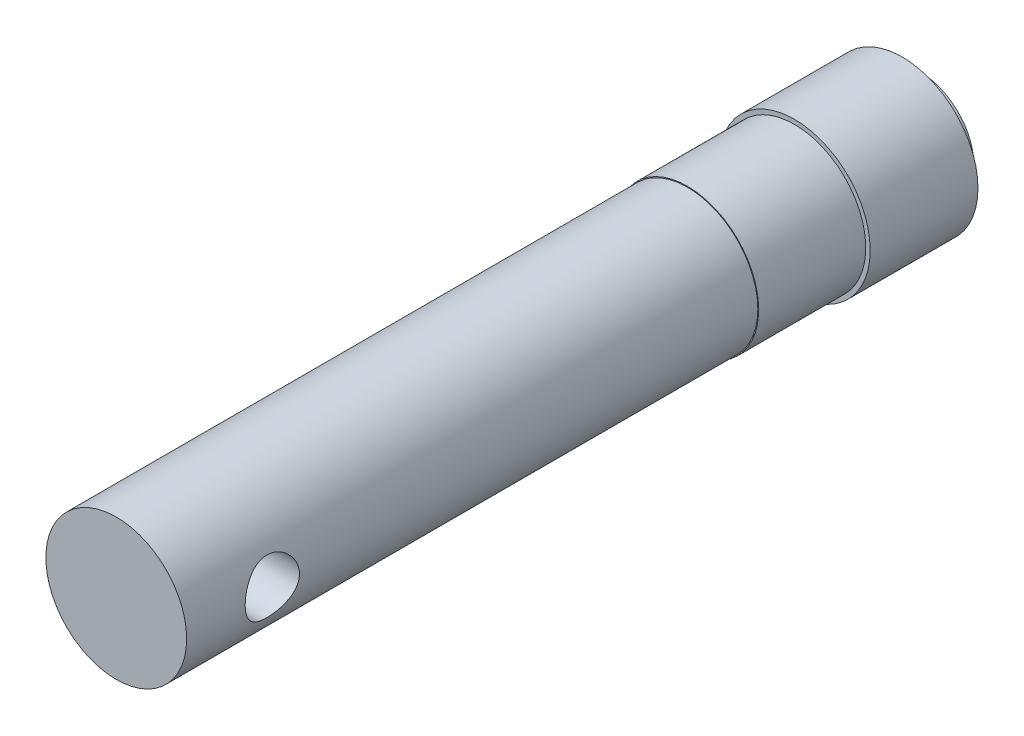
SolidWorks part; units mm, degrees
ref_plane "Front Plane" through (0, 0, 0) normal (0, 0, 1) x (1, 0, 0)
ref_plane "Top Plane" through (0, 0, 0) normal (0, 1, 0) x (1, 0, 0)
ref_plane "Right Plane" through (0, 0, 0) normal (1, 0, 0) x (0, 0, -1)
sketch "Sketch1" plane through (0, 0, 0) normal (0, 0, 1) x (1, 0, 0)
  circle A0 centre (0, 0) radius 13.462
  dimension "D1" = 26.924
extrude "Extrude1" add sketch "Sketch1" along normal mid plane 19.177
sketch "Sketch3" plane through (0, 0, -9.5885) normal (0, 0, -1) x (-1, 0, 0)
  circle A0 centre (0, 0) radius 9.5631
  dimension "D1" = 19.1262
extrude "Extrude3" add sketch "Sketch3" along normal blind 3.175
sketch "Sketch4" plane through (0, 0, 9.5885) normal (0, 0, 1) x (1, 0, 0)
  circle A0 centre (0, 0) radius 12.6746
  dimension "D1" = 25.3492
extrude "Extrude4" add sketch "Sketch4" along normal blind 19.05
sketch "Sketch5" plane through (0, 0, 28.6385) normal (0, 0, 1) x (1, 0, 0)
  circle A0 centre (0, 0) radius 12.5222
  dimension "D1" = 25.0444
extrude "Extrude5" add sketch "Sketch5" along normal blind 101.6
ref_plane "Plane2" through (12.7, 0, 0) normal (1, 0, 0) x (0, 0, -1)
sketch "Sketch7" plane through (12.7, 0, 0) normal (1, 0, 0) x (0, 0, -1)
  line L0 (-130.2385, 12.5222) -> (-130.2385, -12.5222) construction
  circle A0 centre (-114.9985, 0) radius 4.826
  dimension "D2" = 9.652
  dimension "D1" = 15.24
extrude "Cut-Extrude2" cut sketch "Sketch7" against normal through all
